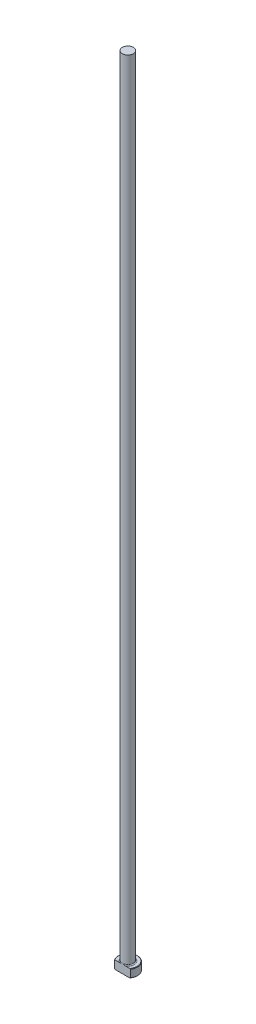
SolidWorks part; units mm, degrees
ref_plane "Front Plane" through (0, 0, 0) normal (0, 0, 1) x (1, 0, 0)
ref_plane "Top Plane" through (0, 0, 0) normal (0, 1, 0) x (1, 0, 0)
ref_plane "Right Plane" through (0, 0, 0) normal (1, 0, 0) x (0, 0, -1)
sketch "Sketch1" plane through (0, 0, 0) normal (0, 0, 1) x (1, 0, 0)
  line L0 (0, 259.9588) -> (0, -15.1925) construction
  line L1 (0, 0) -> (-5.5499, 0)
  line L2 (-5.5499, 0) -> (-5.5499, 4.7498)
  line L3 (-5.5499, 4.7498) -> (-3.175, 4.7498)
  line L4 (-3.175, 4.7498) -> (-3.175, 457.2)
  line L5 (-3.175, 457.2) -> (0, 457.2)
  line L6 (0, 457.2) -> (0, 0)
  dimension "L" = 457.2
  dimension "H" = 11.0998
  dimension "T" = 4.7498
  dimension "D" = 6.35
revolve "Revolve1" add sketch "Sketch1" angle 360 about L0
chamfer "Chamfer1" distance 0.254 angle 45 2 edges at (0, 4.7498, 5.5499) (0, 0, 5.5499)
fillet "Fillet1" radius 0.508 1 edges at (0, 4.7498, 3.175)
sketch "Sketch2" plane through (0, 0, 0) normal (0, -1, 0) x (1, 0, 0)
  line L0 (-4.552, 3.175) -> (4.552, 3.175)
  arc A0 (4.552, 3.175) -> (-4.552, 3.175) centre (0, 0) ccw
  circle A1 centre (0, 0) radius 5.5499 construction
  circle A3 centre (0, 0) radius 3.175 construction
extrude "KEY" cut sketch "Sketch2" against normal through all
sketch "Pocket Sketch" plane through (0, 0, 0) normal (0, 0, 1) x (1, 0, 0)
  line L0 (-5.9468, 0) -> (-5.9468, 4.7752)
  line L1 (-5.9468, 4.7752) -> (-4.3339, 4.7752)
  line L2 (-3.5719, 5.5372) -> (-3.5719, 22.225)
  line L3 (-3.5719, 22.225) -> (0, 22.225)
  line L4 (0, 22.225) -> (0, 0)
  line L5 (0, 0) -> (-5.9468, 0)
  line L6 (0, 12.6104) -> (0, -2.4989) construction
  line L7 (-5.5499, 4.4958) -> (-5.5499, 0.254) construction
  line L8 (5.2959, 4.7498) -> (-5.2959, 4.7498) construction
  line L9 (-3.175, 457.2) -> (-3.175, 5.2578) construction
  line L10 (-4.3339, 4.7752) -> (-3.5719, 5.5372)
  point P3 (-3.5719, 4.7752)
  dimension "D1" = 11.8935
  dimension "D2" = 0.3969
  dimension "D3" = 0.0254
  dimension "D4" = 0.3969
  dimension "D5" = 7.1437
  dimension "D6" = 22.225
